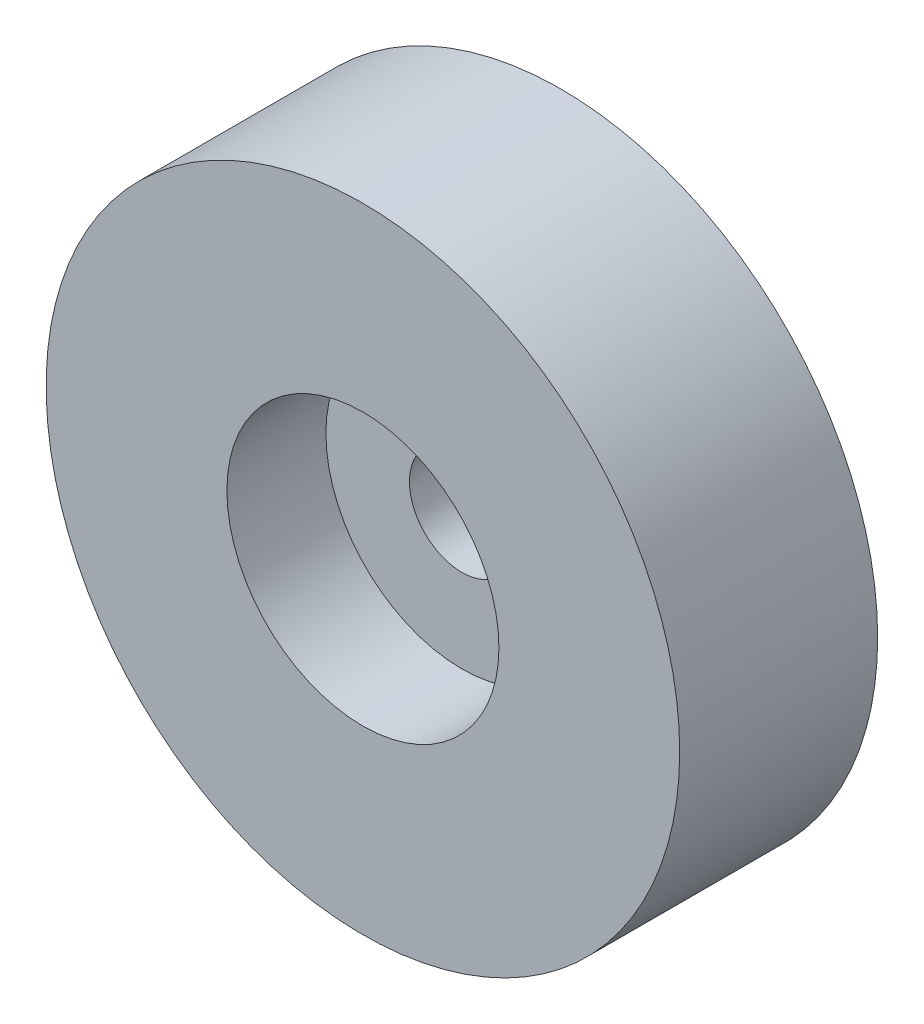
SolidWorks part; units mm, degrees
ref_plane "Plane1" through (0, 0, 0) normal (0, 0, 1) x (1, 0, 0)
ref_plane "Plane2" through (0, 0, 0) normal (0, 1, 0) x (1, 0, 0)
ref_plane "Plane3" through (0, 0, 0) normal (1, 0, 0) x (0, 0, -1)
sketch "Sketch1" plane through (0, 0, 0) normal (0, 0, 1) x (1, 0, 0)
  circle A0 centre (0, 0) radius 20.32
  dimension "D1" = 40.64
extrude "Base-Extrude" add sketch "Sketch1" along normal blind 12.7
sketch "Sketch2" plane through (0, 0, 12.7) normal (0, 0, 1) x (1, 0, 0)
  circle A0 centre (0, 0) radius 8.7249
  dimension "D1" = 17.4498
extrude "Cut-Extrude1" cut sketch "Sketch2" against normal blind 6.35
sketch "Sketch3" plane through (0, 0, 6.35) normal (0, 0, 1) x (1, 0, 0)
  circle A0 centre (0, 0) radius 3.3655
  dimension "D1" = 6.731
extrude "Cut-Extrude2" cut sketch "Sketch3" against normal through all
sketch "Sketch4" plane through (0, 0, 0) normal (0, 0, -1) x (-1, 0, 0)
  circle A0 centre (0, 0) radius 8.509
  circle A1 centre (0, 0) radius 3.3655
  dimension "D1" = 17.018
extrude "Boss-Extrude1" add sketch "Sketch4" along normal blind 7.62
